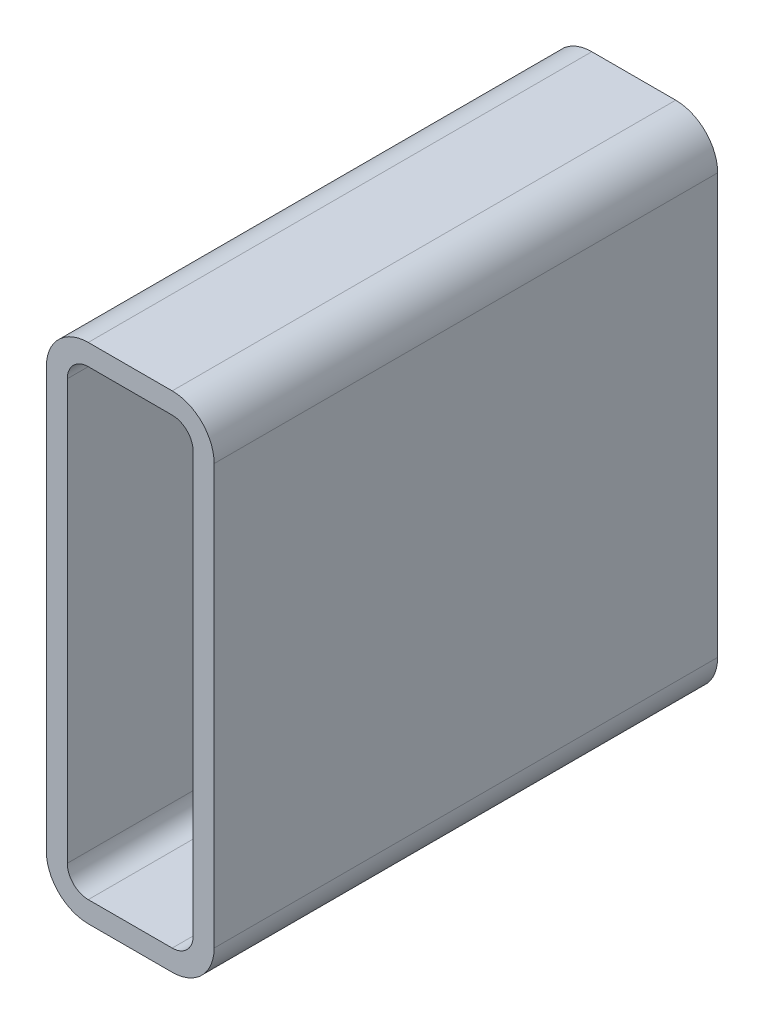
SolidWorks part; units mm, degrees
ref_plane "Front Plane" through (0, 0, 0) normal (0, 0, 1) x (1, 0, 0)
ref_plane "Top Plane" through (0, 0, 0) normal (0, 1, 0) x (1, 0, 0)
ref_plane "Right Plane" through (0, 0, 0) normal (1, 0, 0) x (0, 0, -1)
sketch "Sketch1" plane through (0, 0, 0) normal (0, 0, 1) x (1, 0, 0)
sketch_block_instance "HSS12x4x0.500-1"
sketch_block "HSS12x4x0.500"
extrude "Boss-Extrude1" add sketch "Sketch1" along normal blind 304.8
